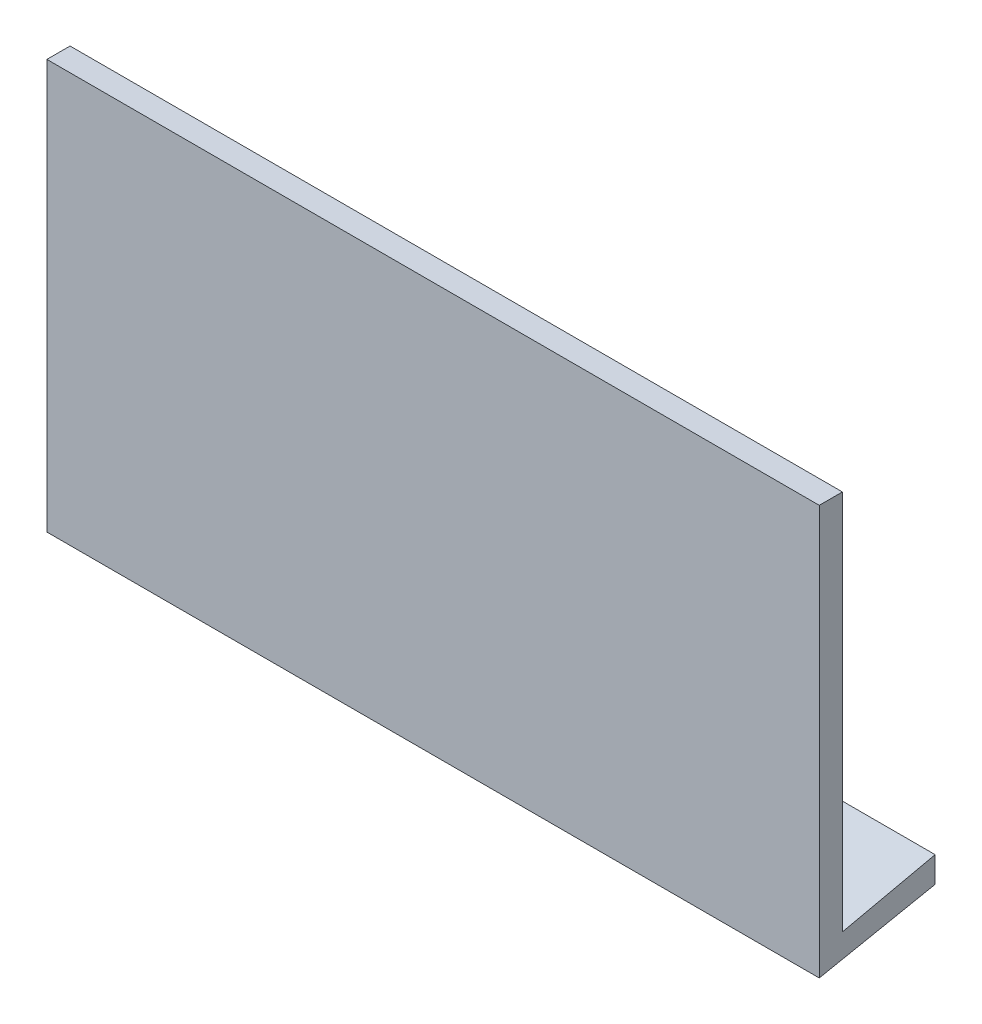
SolidWorks part; units mm, degrees
ref_plane "Plano frontal" through (0, 0, 0) normal (0, 0, 1) x (1, 0, 0)
ref_plane "Plano superior" through (0, 0, 0) normal (0, 1, 0) x (1, 0, 0)
ref_plane "Plano direito" through (0, 0, 0) normal (1, 0, 0) x (0, 0, -1)
sketch "Esboço2" plane through (0, 0, 0) normal (0, 0, 1) x (1, 0, 0)
  line L0 (-1000, 0) -> (49000, 0) construction
  line L1 (-1000, -300) -> (49000, -300) construction
  line L2 (0.0497, -1197.0011) -> (0.0497, 48802.9989) construction
  line L3 (-299.9503, -1197.0011) -> (-299.9503, 48802.9989) construction
  line L4 (300.0497, -1197.0011) -> (300.0497, 48802.9989) construction
  line L6 (-299.9503, 0) -> (300.0497, 0)
  line L7 (-299.9503, 0) -> (-299.9503, -300)
  line L8 (-299.9503, -300) -> (300.0497, -300)
  line L9 (300.0497, 0) -> (300.0497, -300)
  line L10 (-299.9503, 0) -> (300.0497, -300) construction
  line L11 (-299.9503, -300) -> (300.0497, 0) construction
  point P15 (0.0497, -150)
  dimension "D1" = 300
  dimension "D2" = 300
  dimension "D3" = 300
extrude "Ressalto-extrusão1" add sketch "Esboço2" along normal blind 18
sketch "Esboço4" plane through (300.0497, 0, 0) normal (1, 0, 0) x (0, 0, -1)
  line L0 (-1000, -300) -> (49000, -300) construction
  line L1 (-1000, -318) -> (49000, -318) construction
  line L2 (-1000, -280) -> (49000, -280) construction
  line L3 (-18, -1280) -> (-18, 48720) construction
  line L5 (72, -1280) -> (72, 48720) construction
  line L6 (-18, -318) -> (72, -300)
  line L7 (72, -300) -> (72, -280)
  line L8 (72, -280) -> (-18, -300)
  line L9 (-18, -300) -> (-18, -318)
  dimension "D1" = 18
  dimension "D2" = 20
  dimension "D3" = 90
extrude "Ressalto-extrusão3" add sketch "Esboço4" against normal up to vertex (600 mm away)
